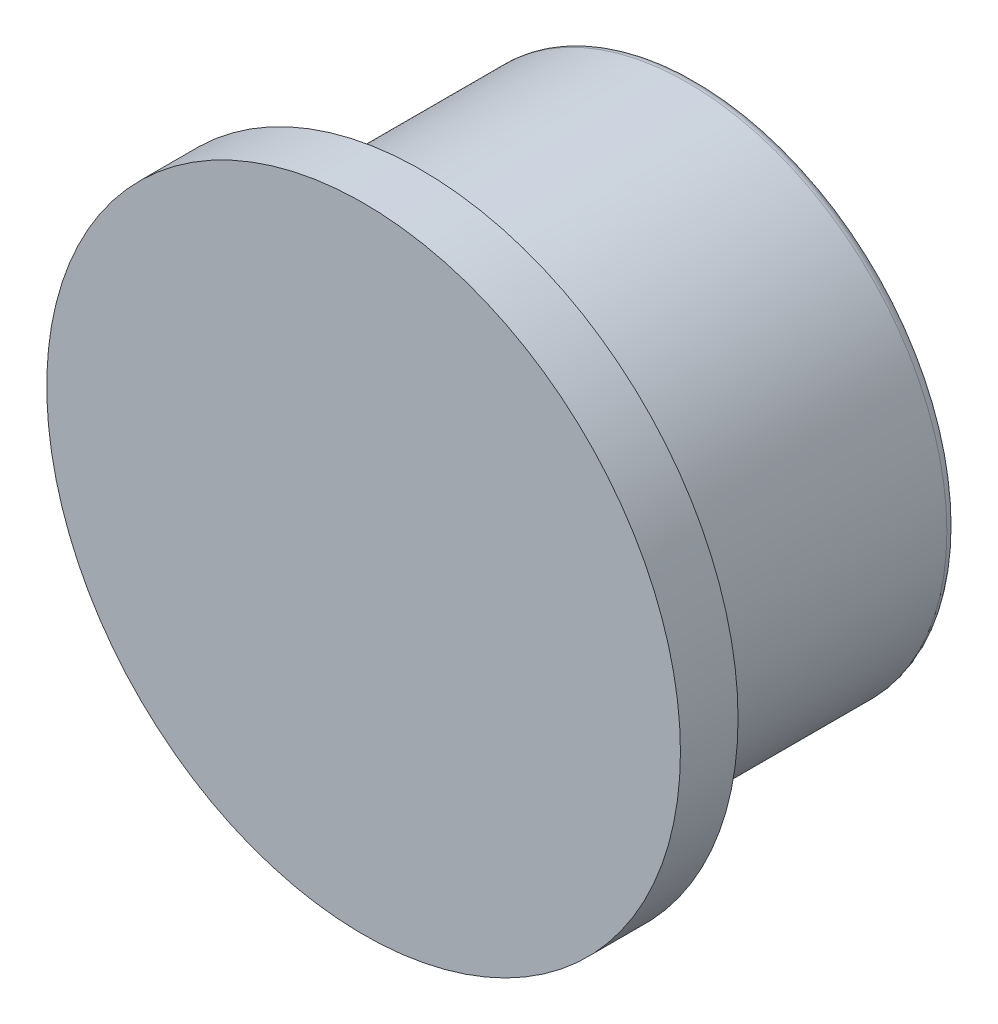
SolidWorks part; units mm, degrees
ref_plane "Front Plane" through (0, 0, 0) normal (0, 0, 1) x (1, 0, 0)
ref_plane "Top Plane" through (0, 0, 0) normal (0, 1, 0) x (1, 0, 0)
ref_plane "Right Plane" through (0, 0, 0) normal (1, 0, 0) x (0, 0, -1)
sketch "Sketch1" plane through (0, 0, 0) normal (1, 0, 0) x (0, 0, -1)
  line L0 (0, 0) -> (58, 0) construction
  line L1 (0, 0) -> (0, 55)
  line L2 (0, 55) -> (10, 55)
  line L3 (10, 55) -> (10, 45)
  line L4 (10, 45) -> (56.25, 45)
  line L5 (58, 43.25) -> (58, 0)
  line L6 (0, 0) -> (58, 0)
  arc A0 (56.25, 45) -> (58, 43.25) centre (56.25, 43.25) cw
  point P9 (58, 45)
  dimension "D5" = 1.75
  dimension "D1" = 110
  dimension "D2" = 90
  dimension "D3" = 10
  dimension "D4" = 48
revolve "Revolve1" add sketch "Sketch1" angle 360 about L0
hole_wizard "M8x1.0 Tapped Hole1" positions "Sketch3" profile "Sketch2" tap size "M8x1.0" standard "AS"
sketch "Sketch3" plane through (0, 0, -58) normal (0, 0, -1) x (-1, 0, 0)
  point P0 (0, 0)
sketch "Sketch2" plane through (0, 0, -58) normal (1, 0, 0) x (0, 1, 0)
  line L0 (0, 0) -> (0, 18.103)
  line L1 (0, 18.103) -> (3.5, 16)
  line L2 (3.5, 16) -> (3.5, 0.525)
  line L3 (3.5, 0.525) -> (4.025, 0)
  line L5 (4.025, 0) -> (0, 0)
  line L6 (-3.5, 0.525) -> (-4.025, 0) construction
  line L10 (0, 18.103) -> (-3.5, 16) construction
  line L11 (0, -6.35) -> (0, 107.95) construction
  dimension "Tap Drill Dia." = 7
  dimension "Tap Drill Depth" = 16
  dimension "Near C'Sink Dia." = 8.05
  dimension "Near C'Sink Angle" = 90
  dimension "Drill Angle" = 118
